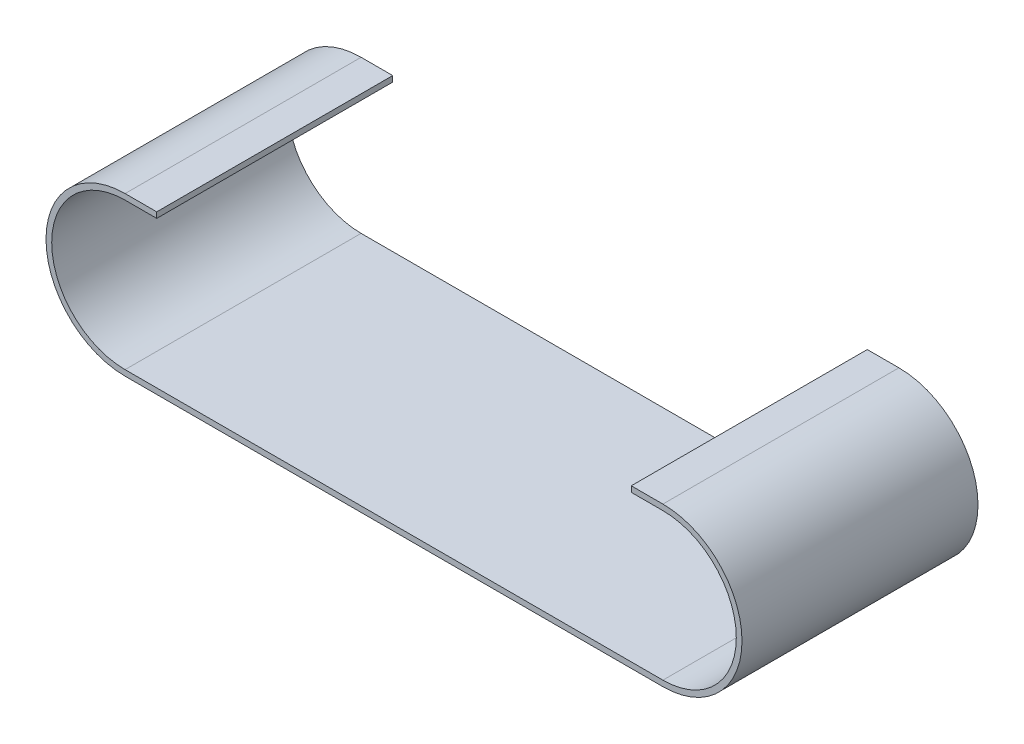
SolidWorks part; units mm, degrees
ref_plane "Plan de face" through (0, 0, 0) normal (0, 0, 1) x (1, 0, 0)
ref_plane "Plan de dessus" through (0, 0, 0) normal (0, 1, 0) x (1, 0, 0)
ref_plane "Plan de droite" through (0, 0, 0) normal (1, 0, 0) x (0, 0, -1)
sketch "Esquisse1" plane through (0, 0, 0) normal (0, 0, 1) x (1, 0, 0)
  line L0 (-850, 250) -> (-750, 250)
  line L1 (-850, -250) -> (850, -250)
  line L5 (850, 250) -> (750, 250)
  line L6 (-850, 232) -> (-750, 232)
  line L7 (-850, -232) -> (850, -232)
  line L8 (850, 232) -> (750, 232)
  line L9 (-750, 250) -> (-750, 232)
  line L10 (750, 250) -> (750, 232)
  arc A0 (-850, 250) -> (-850, -250) centre (-850, 0) ccw
  arc A1 (850, -250) -> (850, 250) centre (850, 0) ccw
  arc A2 (-850, 232) -> (-850, -232) centre (-850, 0) ccw
  arc A3 (850, -232) -> (850, 232) centre (850, 0) ccw
  point P0 (0, 0)
  dimension "D2" = 500
  dimension "D3" = 500
  dimension "D1" = 100
  dimension "D4" = 100
  dimension "D5" = 18
extrude "Boss.-Extru.1" add sketch "Esquisse1" against normal blind 746
